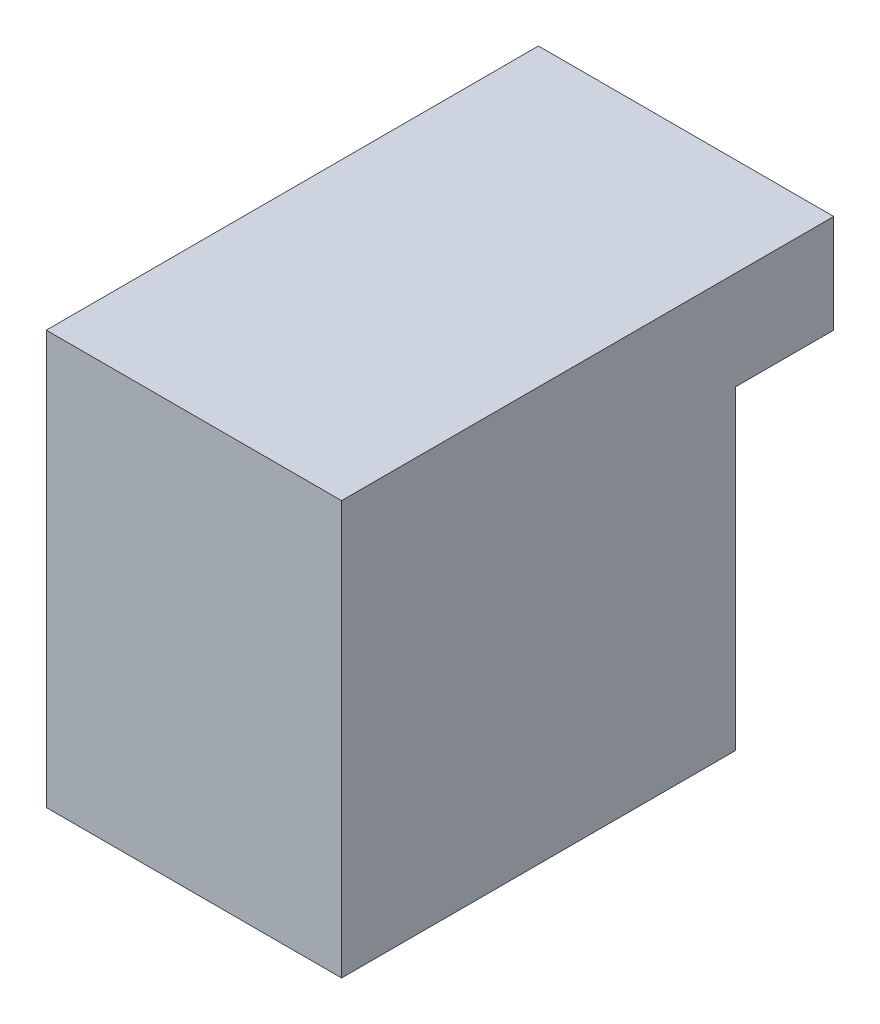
SolidWorks part; units mm, degrees
ref_plane "Front Plane" through (0, 0, 0) normal (0, 0, 1) x (1, 0, 0)
ref_plane "Top Plane" through (0, 0, 0) normal (0, 1, 0) x (1, 0, 0)
ref_plane "Right Plane" through (0, 0, 0) normal (1, 0, 0) x (0, 0, -1)
sketch "Sketch1" plane through (0, 0, 0) normal (1, 0, 0) x (0, 0, -1)
  line L0 (-17.1818, 7.9091) -> (-17.1818, -13.0909)
  line L1 (-17.1818, -13.0909) -> (2.8182, -13.0909)
  line L2 (2.8182, -13.0909) -> (2.8182, 2.9091)
  line L3 (2.8182, 2.9091) -> (7.8182, 2.9091)
  line L4 (7.8182, 2.9091) -> (7.8182, 7.9091)
  line L5 (7.8182, 7.9091) -> (-17.1818, 7.9091)
  point P2 (0, 0)
  dimension "D1" = 25
  dimension "D2" = 5
  dimension "D3" = 21
  dimension "D4" = 16
  dimension "D5" = 20
extrude "cerrojo" add sketch "Sketch1" along normal mid plane 15
